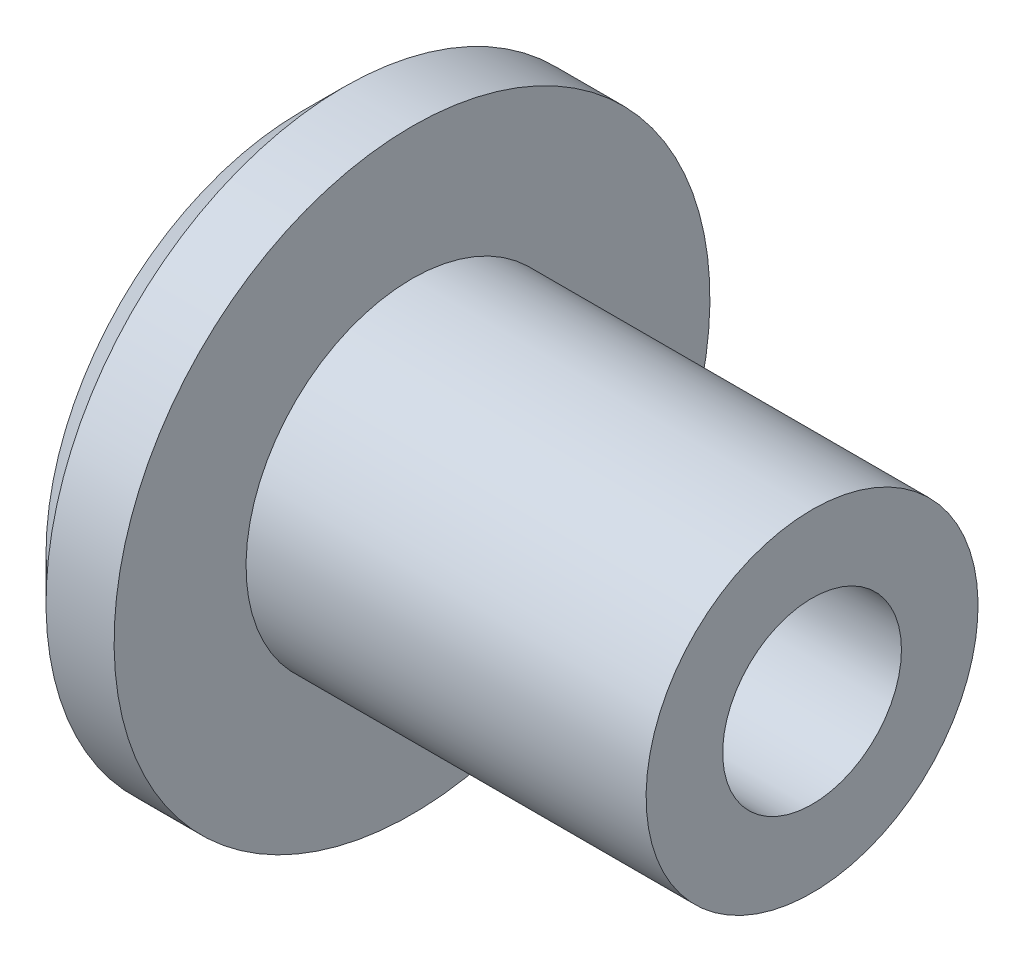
SolidWorks part; units mm, degrees
ref_plane "Front Plane" through (0, 0, 0) normal (0, 0, 1) x (1, 0, 0)
ref_plane "Top Plane" through (0, 0, 0) normal (0, 1, 0) x (1, 0, 0)
ref_plane "Right Plane" through (0, 0, 0) normal (1, 0, 0) x (0, 0, -1)
sketch "Sketch1" plane through (0, 0, 0) normal (0, 0, 1) x (1, 0, 0)
  line L0 (0, 0) -> (0, 6)
  line L1 (0, 6) -> (1, 7)
  line L2 (1, 7) -> (2.6, 7)
  line L3 (2.6, 7) -> (2.6, 3.9)
  line L4 (2.6, 3.9) -> (12, 3.9)
  line L5 (12, 3.9) -> (12, 0)
  line L6 (12, 0) -> (0, 0)
  dimension "D1" = 3.9
  dimension "D2" = 7
  dimension "D3" = 1
  dimension "D4" = 1
  dimension "D5" = 9.4
  dimension "D6" = 12
revolve "Revolve1" add sketch "Sketch1" angle 360 about L6
hole_wizard "M5 Tapped Hole1" positions "3DSketch1" profile "Sketch3" tap size "M5" standard "ISO"
sketch3d "3DSketch1"
  line L0 (2.6, 0, 0) -> (12, 0, 0) construction
  point P0 (12, 0, 0)
sketch "Sketch3" plane through (12, 0, 0) normal (0, 1, 0) x (0, 0, -1)
  line L0 (0, 0) -> (0, 12)
  line L1 (0, 12) -> (2.1, 12)
  line L2 (2.1, 12) -> (2.1, 0)
  line L5 (2.1, 0) -> (0, 0)
  line L11 (0, -6.35) -> (0, 107.95) construction
  dimension "Thru Tap Drill Dia." = 4.2
  dimension "Thru Tap Drill Depth" = 12
